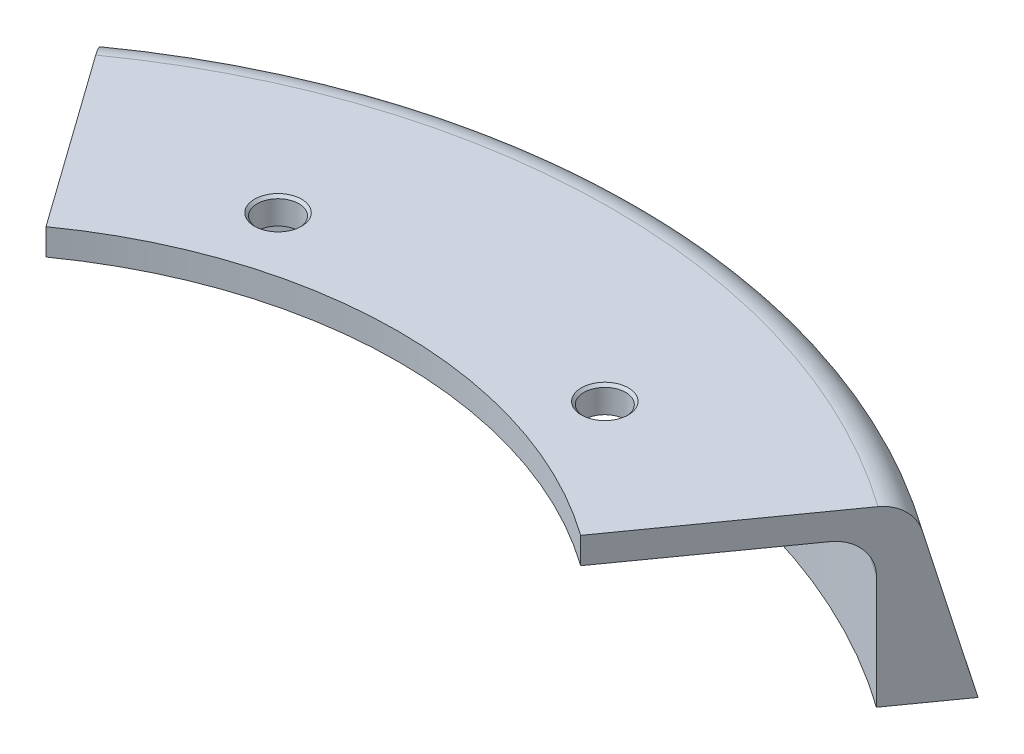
SolidWorks part; units mm, degrees
ref_plane "Front Plane" through (0, 0, 0) normal (0, 0, 1) x (1, 0, 0)
ref_plane "Top Plane" through (0, 0, 0) normal (0, 1, 0) x (1, 0, 0)
ref_plane "Right Plane" through (0, 0, 0) normal (1, 0, 0) x (0, 0, -1)
sketch "Sketch1" plane through (0, 0, 0) normal (1, 0, 0) x (0, 0, -1)
  line L0 (0, -1842.899) -> (0, 90302.0499) construction
  line L1 (111.125, 6.35) -> (111.125, 0)
  line L2 (111.125, 0) -> (162.306, 0)
  line L3 (162.306, 0) -> (162.306, -35.56)
  line L4 (162.306, -35.56) -> (179.8858, -35.56)
  line L5 (179.8858, -35.56) -> (168.656, 6.35)
  line L6 (168.656, 6.35) -> (111.125, 6.35)
  line L7 (168.656, 6.35) -> (162.306, 0) construction
  point P9 (168.0522, 6.35)
  dimension "D1" = 111.125
  dimension "D2" = 75
  dimension "D3" = 162.306
  dimension "D4" = 6.35
  dimension "D5" = 35.56
  dimension "D6" = 45
revolve "Revolve1" add sketch "Sketch1" angle 71 mid plane about L0
hole_wizard "3/8 Clearance Hole1" positions "Sketch2" profile "Sketch3" hole size "3/8" standard "ANSI Inch"
sketch "Sketch2" plane through (0, 6.35, 0) normal (0, 1, 0) x (1, 0, 0)
  line L0 (-39.4414, 121.3881) -> (-34.3395, 105.6862)
  line L2 (0, -1000) -> (0, 49000) construction
  arc A2 (64.5306, 90.4686) -> (-64.5306, 90.4686) centre (0, 0) ccw construction
  point P0 (-39.4414, 121.3881)
  dimension "D1" = 16.51
  dimension "D2" = 18
sketch "Sketch3" plane through (-39.4414, 6.35, -121.3881) normal (1, 0, 0) x (0, 0, 1)
  line L0 (0, 0) -> (0, 6.351)
  line L1 (0, 6.351) -> (5.0419, 6.351)
  line L2 (5.0419, 6.351) -> (5.0419, 0.635)
  line L3 (5.0419, 0.635) -> (5.6769, 0)
  line L5 (5.6769, 0) -> (0, 0)
  line L6 (-5.0419, 0.635) -> (-5.6769, 0) construction
  line L11 (0, -6.35) -> (0, 107.95) construction
  dimension "Thru Hole Dia." = 10.0838
  dimension "Thru Hole Depth" = 6.351
  dimension "Near C'Sink Dia." = 11.3538
  dimension "Near C'Sink Angle" = 90
mirror "Mirror1" about plane through (0, 0, 0) normal (1, 0, 0) of "3/8 Clearance Hole1"
shell "Shell1" thickness 6.35
sketch "Sketch5" plane through (0, 0, 0) normal (1, 0, 0) x (0, 0, -1)
  line L0 (168.656, -35.56) -> (173.3117, -35.56)
rib "Rib5" sketch "Sketch5" sketch "Sketch5" thickness 6.35 extrusion direction parallel to sketch draft on no parameters "D1"=6.35
sketch "Sketch4" plane through (0, 0, 0) normal (0, 0, 1) x (1, 0, 0)
  line L0 (-73.6141, -17.78) -> (-20.6375, -17.78) construction
  line L3 (-73.6141, -11.43) -> (-20.6375, -11.43)
  line L4 (-73.6141, -24.13) -> (-20.6375, -24.13)
  line L5 (-20.6375, -17.78) -> (0, -17.78) construction
  line L6 (20.6375, -17.78) -> (73.6141, -17.78) construction
  line L7 (20.6375, -11.43) -> (73.6141, -11.43)
  line L8 (20.6375, -24.13) -> (73.6141, -24.13)
  line L9 (0, -17.78) -> (20.6375, -17.78) construction
  line L10 (0, -35.56) -> (0, -17.78) construction
  line L11 (-94.2516, -35.56) -> (94.2516, -35.56) construction
  line L12 (0, -17.78) -> (0, 0) construction
  line L13 (-73.6141, -17.78) -> (-94.2516, -17.78) construction
  line L14 (-94.2516, 0) -> (-94.2516, -35.56) construction
  line L15 (73.6141, -17.78) -> (94.2516, -17.78) construction
  line L16 (94.2516, 0) -> (94.2516, -35.56) construction
  arc A2 (-73.6141, -11.43) -> (-73.6141, -24.13) centre (-73.6141, -17.78) ccw
  arc A3 (-20.6375, -24.13) -> (-20.6375, -11.43) centre (-20.6375, -17.78) ccw
  arc A4 (20.6375, -11.43) -> (20.6375, -24.13) centre (20.6375, -17.78) ccw
  arc A5 (73.6141, -24.13) -> (73.6141, -11.43) centre (73.6141, -17.78) ccw
  point P2 (-47.1258, -17.78)
  point P10 (47.1258, -17.78)
  dimension "D2" = 12.7
  dimension "D1" = 41.275
extrude "Cut-Extrude1" [suppressed] cut sketch "Sketch4" against normal up to surface (167.3886 mm away)
fillet "Fillet1" [suppressed] radius 3.175
fillet "Fillet2" radius 7.9375 2 edges at (0, 0, -162.306) (0, 6.35, -168.656)
fillet "Fillet3" [suppressed] radius 3.175
